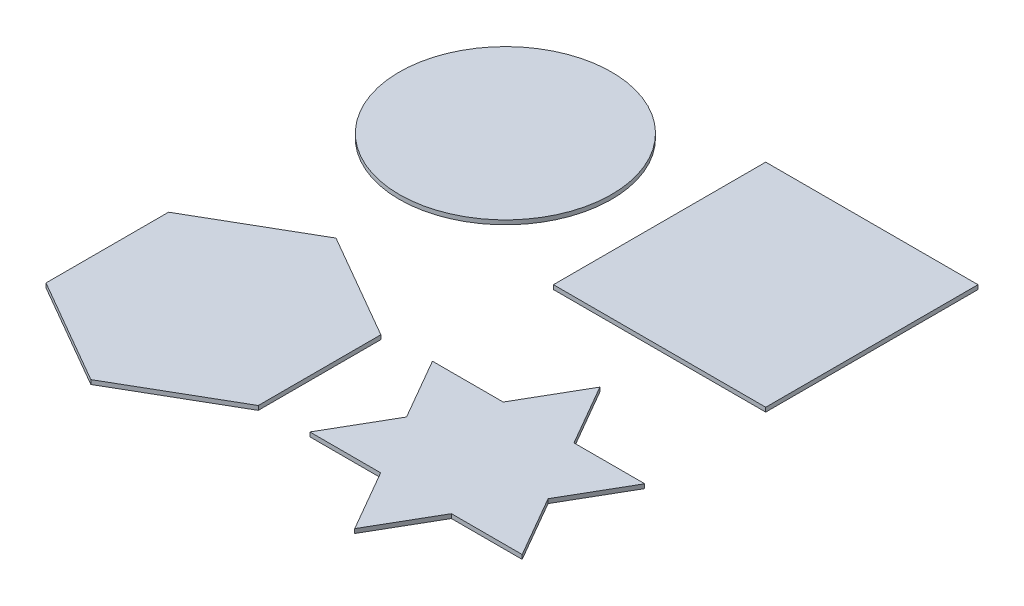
SolidWorks part; units mm, degrees
ref_plane "Front Plane" through (0, 0, 0) normal (0, 0, 1) x (1, 0, 0)
ref_plane "Top Plane" through (0, 0, 0) normal (0, 1, 0) x (1, 0, 0)
ref_plane "Right Plane" through (0, 0, 0) normal (1, 0, 0) x (0, 0, -1)
sketch "Sketch1" plane through (0, 0, 0) normal (0, 1, 0) x (1, 0, 0)
  line L0 (62.9015, -40.654) -> (71.2348, -55.0877)
  line L1 (36.5433, 24.7674) -> (86.5433, 24.7674)
  line L2 (36.5433, 24.7674) -> (36.5433, -25.2326)
  line L3 (36.5433, -25.2326) -> (86.5433, -25.2326)
  line L4 (86.5433, 24.7674) -> (86.5433, -25.2326)
  line L5 (1.4284, -41.3353) -> (-23.5716, -55.7691)
  line L6 (-23.5716, -55.7691) -> (-23.5716, -84.6366)
  line L7 (-23.5716, -84.6366) -> (1.4284, -99.0703)
  line L8 (1.4284, -99.0703) -> (26.4284, -84.6366)
  line L9 (26.4284, -84.6366) -> (26.4284, -55.7691)
  line L10 (26.4284, -55.7691) -> (1.4284, -41.3353)
  line L11 (62.9015, -40.654) -> (37.9015, -55.0877) construction
  line L12 (37.9015, -55.0877) -> (37.9015, -83.9552) construction
  line L13 (37.9015, -83.9552) -> (62.9015, -98.389) construction
  line L14 (62.9015, -98.389) -> (87.9015, -83.9552) construction
  line L15 (87.9015, -83.9552) -> (87.9015, -55.0877) construction
  line L16 (87.9015, -55.0877) -> (62.9015, -40.654) construction
  line L18 (37.9015, -55.0877) -> (54.5682, -55.0877)
  line L19 (87.9015, -55.0877) -> (79.5682, -69.5215)
  line L21 (62.9015, -40.654) -> (54.5682, -55.0877)
  line L22 (37.9015, -83.9552) -> (54.5682, -83.9552)
  line L23 (37.9015, -55.0877) -> (46.2348, -69.5215)
  line L24 (46.2348, -69.5215) -> (37.9015, -83.9552)
  line L26 (79.5682, -69.5215) -> (87.9015, -83.9552)
  line L27 (71.2348, -83.9552) -> (62.9015, -98.389)
  line L29 (54.5682, -83.9552) -> (62.9015, -98.389)
  line L30 (71.2348, -55.0877) -> (87.9015, -55.0877)
  line L31 (71.2348, -83.9552) -> (87.9015, -83.9552)
  circle A0 centre (0, 0) radius 25
  circle A1 centre (1.4284, -70.2028) radius 25 construction
  circle A2 centre (62.9015, -69.5215) radius 25 construction
  dimension "D1" = 50
  dimension "D4" = 50
  dimension "D5" = 50
  dimension "D2" = 50
  dimension "D3" = 50
extrude "Extrude1" add sketch "Sketch1" along normal blind 1
